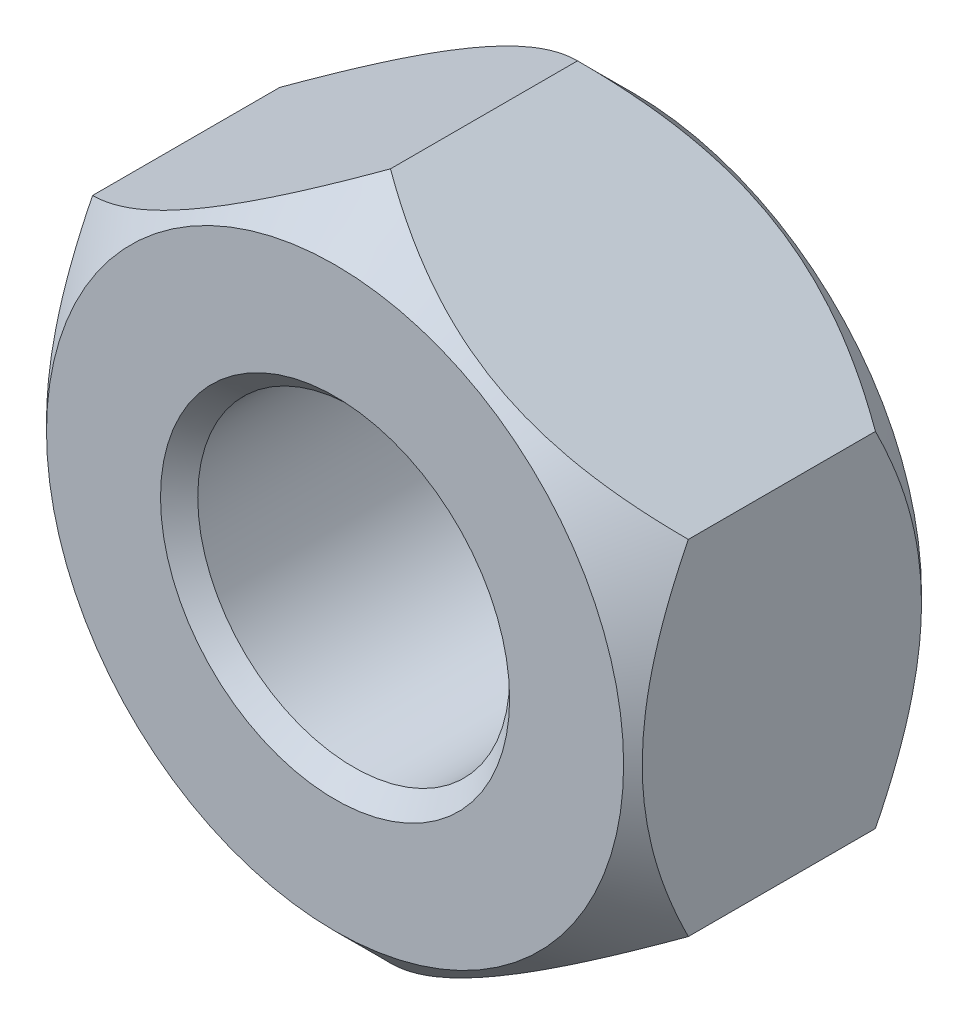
SolidWorks part; units mm, degrees
ref_plane "Płaszczyzna przednia" through (0, 0, 0) normal (0, 0, 1) x (1, 0, 0)
ref_plane "Płaszczyzna górna" through (0, 0, 0) normal (0, 1, 0) x (1, 0, 0)
ref_plane "Płaszczyzna prawa" through (0, 0, 0) normal (1, 0, 0) x (0, 0, -1)
sketch "Szkic1" plane through (0, 0, 0) normal (0, 0, 1) x (1, 0, 0)
  line L1 (-8, 4.6188) -> (-8, -4.6188)
  line L2 (-8, -4.6188) -> (0, -9.2376)
  line L3 (0, -9.2376) -> (8, -4.6188)
  line L4 (8, -4.6188) -> (8, 4.6188)
  line L5 (8, 4.6188) -> (0, 9.2376)
  line L6 (0, 9.2376) -> (-8, 4.6188)
  circle A0 centre (0, 0) radius 4.188
  circle A1 centre (0, 0) radius 8 construction
  dimension "D1" = 8.376
  dimension "D2" = 16
extrude "Dodanie-wyciągnięcie1" add sketch "Szkic1" along normal mid plane 8
sketch "Szkic2" plane through (0, 0, 4) normal (0, 0, 1) x (1, 0, 0)
  circle A0 centre (0, 0) radius 7.75
  dimension "D1" = 15.5
extrude "Wytnij-wyciągnięcie1" cut sketch "Szkic2" against normal through all draft 45 and the other way through all flip side to cut
mirror "Lustro1" about plane through (0, 0, 0) normal (0, 0, 1) of "Wytnij-wyciągnięcie1"
chamfer "Sfazowanie1" distance 0.5 angle 45 2 edges at (4.188, 0, -4) (4.188, 0, 4)
